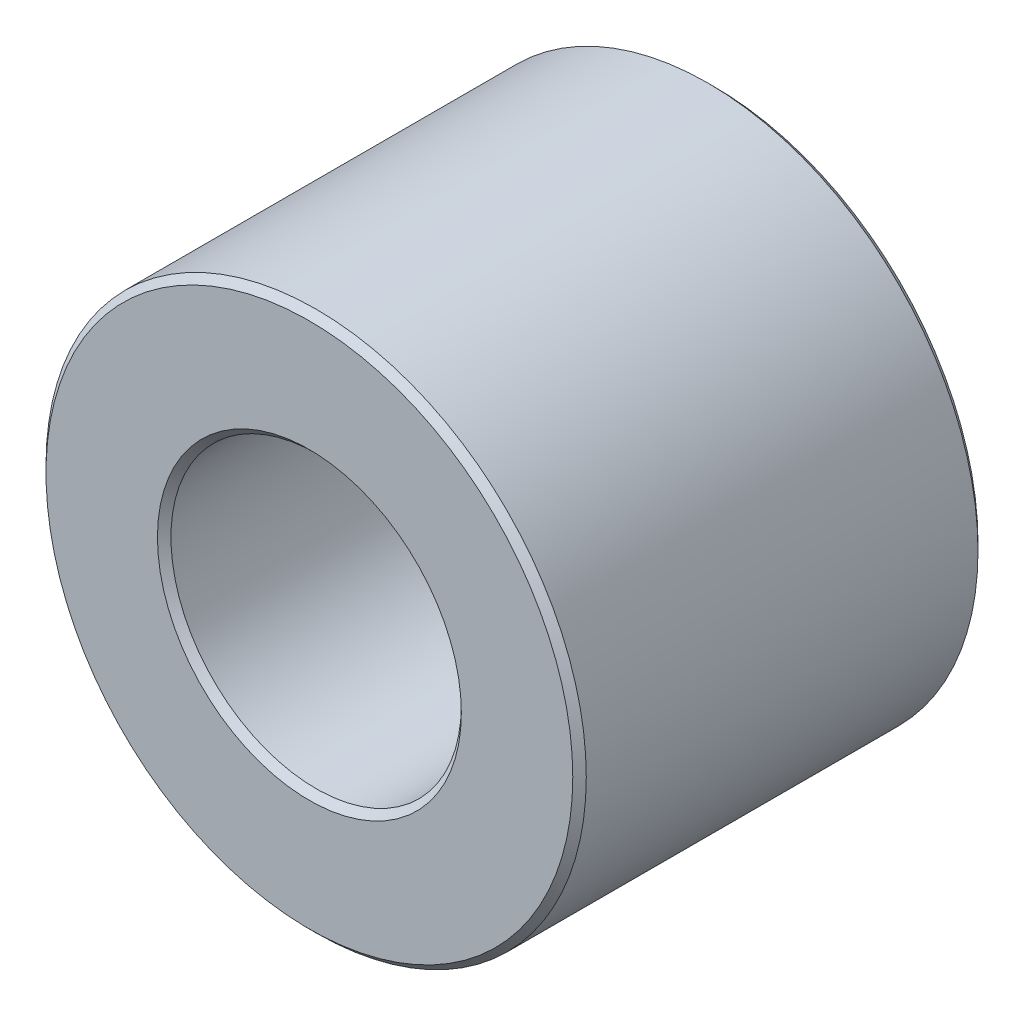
SolidWorks part; units mm, degrees
ref_plane "Front Plane" through (0, 0, 0) normal (0, 0, 1) x (1, 0, 0)
ref_plane "Top Plane" through (0, 0, 0) normal (0, 1, 0) x (1, 0, 0)
ref_plane "Right Plane" through (0, 0, 0) normal (1, 0, 0) x (0, 0, -1)
sketch "Sketch1" plane through (0, 0, 0) normal (0, 0, 1) x (1, 0, 0)
  circle A0 centre (0, 0) radius 4
  circle A1 centre (0, 0) radius 2.15
  dimension "D1" = 8
  dimension "D2" = 4.3
extrude "Boss-Extrude2" add sketch "Sketch1" along normal mid plane 6
chamfer "Chamfer3" distance 0.1 angle 45 4 edges at (4, 0, 3) (4, 0, -3) (2.15, 0, -3) (2.15, 0, 3)
